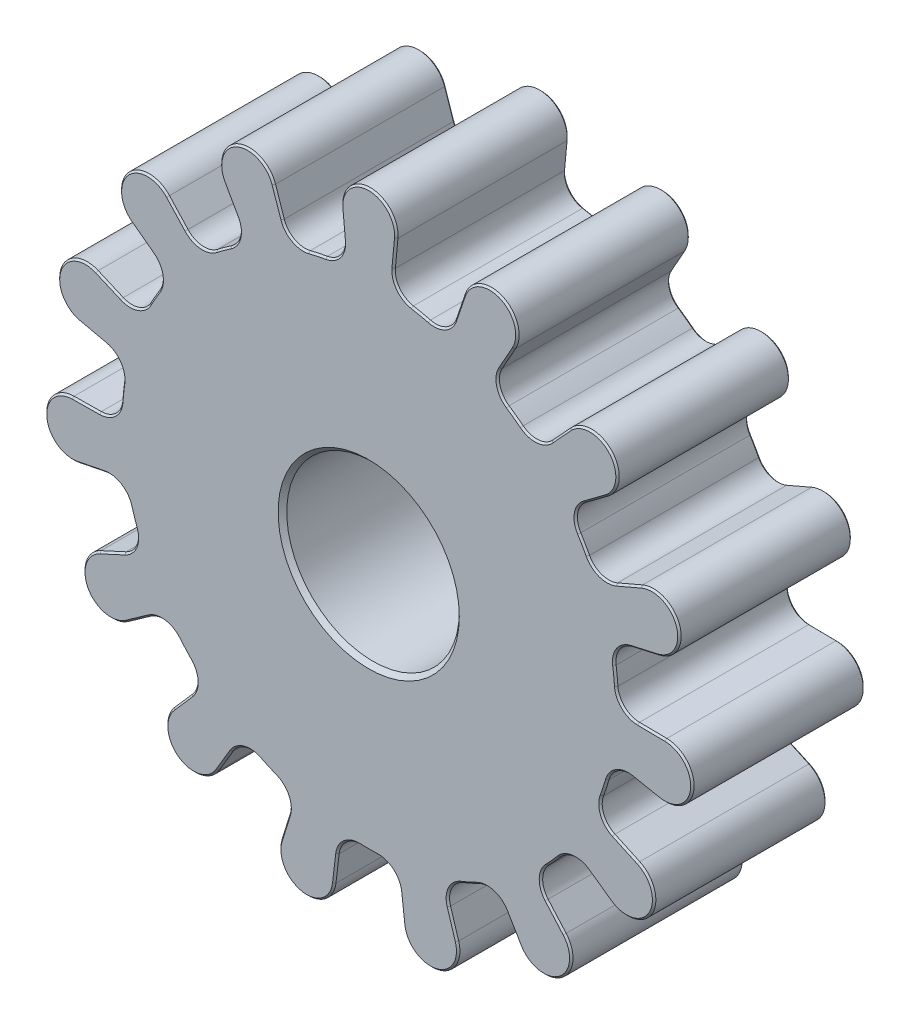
SolidWorks part; units mm, degrees
ref_plane "Спереди" through (0, 0, 0) normal (0, 0, 1) x (1, 0, 0)
ref_plane "Сверху" through (0, 0, 0) normal (0, 1, 0) x (1, 0, 0)
ref_plane "Справа" through (0, 0, 0) normal (1, 0, 0) x (0, 0, -1)
sketch "Эскиз1" plane through (0, 0, 0) normal (0, 0, 1) x (1, 0, 0)
  line L0 (-1.4463, 15.5261) -> (-1.5931, 17.1016)
  line L1 (1.4463, 15.5261) -> (1.5931, 17.1016)
  line L2 (4.9938, 14.7721) -> (5.5005, 16.2711)
  line L3 (7.6364, 13.5956) -> (8.4112, 14.9751)
  line L4 (10.5704, 11.4639) -> (11.643, 12.6271)
  line L5 (12.506, 9.3142) -> (13.775, 10.2593)
  line L6 (14.3193, 6.1734) -> (15.7723, 6.7998)
  line L7 (15.2132, 3.4223) -> (16.7569, 3.7696)
  line L8 (15.5923, -0.1845) -> (17.1744, -0.2032)
  line L9 (15.2899, -3.0613) -> (16.8414, -3.372)
  line L10 (14.1692, -6.5105) -> (15.607, -7.1711)
  line L11 (12.7229, -9.0156) -> (14.0139, -9.9305)
  line L12 (10.2962, -11.7108) -> (11.3409, -12.8991)
  line L13 (7.9559, -13.4111) -> (8.7632, -14.7719)
  line L14 (4.6428, -14.8862) -> (5.1139, -16.3967)
  line L15 (1.8133, -15.4876) -> (1.9973, -17.0591)
  line L16 (-1.8133, -15.4876) -> (-1.9973, -17.0591)
  line L17 (-4.6428, -14.8862) -> (-5.1139, -16.3967)
  line L18 (-7.9559, -13.4111) -> (-8.7632, -14.7719)
  line L19 (-10.2962, -11.7108) -> (-11.3409, -12.8991)
  line L20 (-12.7229, -9.0156) -> (-14.0139, -9.9305)
  line L21 (-14.1692, -6.5105) -> (-15.607, -7.1711)
  line L22 (-15.2899, -3.0613) -> (-16.8414, -3.372)
  line L23 (-15.5923, -0.1845) -> (-17.1744, -0.2032)
  line L24 (-15.2132, 3.4223) -> (-16.7569, 3.7696)
  line L25 (-14.3193, 6.1734) -> (-15.7723, 6.7998)
  line L26 (-12.506, 9.3142) -> (-13.775, 10.2593)
  line L27 (-10.5704, 11.4639) -> (-11.643, 12.6271)
  line L28 (-7.6364, 13.5956) -> (-8.4112, 14.9751)
  line L29 (-4.9938, 14.7721) -> (-5.5005, 16.2711)
  line L32 (-1.2117, 13.0078) -> (-1.2944, 13.8952)
  line L33 (1.1863, 12.7348) -> (1.3, 13.9549)
  line L34 (2.7413, 11.8981) -> (3.0267, 12.7424)
  line L35 (4.9134, 11.4047) -> (5.5135, 12.4731)
  line L36 (6.729, 11.0759) -> (7.3332, 11.7311)
  line L37 (9.1147, 10.0723) -> (10.0974, 10.8042)
  line L38 (11.5109, 9.1116) -> (12.3293, 9.4645)
  line L39 (13.7853, 6.9624) -> (14.9808, 7.2314)
  line L40 (16.0254, 4.5549) -> (16.9166, 4.5443)
  line L41 (17.2944, 1.1325) -> (18.4959, 0.8919)
  line L42 (18.1908, -2.6333) -> (19.0006, -3.0055)
  line L43 (17.6171, -6.697) -> (18.6169, -7.4054)
  line L44 (16.3227, -10.8344) -> (16.9112, -11.5038)
  line L45 (13.629, -14.3946) -> (14.2542, -15.4485)
  line L46 (10.138, -17.4971) -> (10.4034, -18.3479)
  line L47 (5.8262, -19.3836) -> (5.9687, -20.6007)
  line L48 (1.0523, -20.2836) -> (0.9487, -21.1688)
  line L49 (-3.7354, -19.8139) -> (-4.1002, -20.9837)
  line L50 (-8.3199, -18.1303) -> (-8.7746, -18.8968)
  line L51 (-12.2391, -15.4158) -> (-13.0482, -16.336)
  line L52 (-15.2314, -11.7338) -> (-15.9586, -12.2491)
  line L53 (-17.2688, -7.6338) -> (-18.3823, -8.1455)
  line L54 (-17.9257, -3.2337) -> (-18.7996, -3.4087)
  line L55 (-17.7746, 1.0201) -> (-18.9999, 1.0056)
  line L56 (-16.2777, 4.7483) -> (-17.1473, 4.9439)
  line L57 (-14.3793, 8.0703) -> (-15.5046, 8.5554)
  line L58 (-11.6519, 10.2296) -> (-12.3667, 10.762)
  line L59 (-8.8969, 12.0867) -> (-9.7275, 12.9875)
  line L60 (-6.0802, 12.6003) -> (-6.5167, 13.3774)
  line L61 (-3.3334, 13.1231) -> (-3.7259, 14.2839)
  circle A0 centre (0, 0) radius 17.25 construction
  arc A1 (1.5931, 17.1016) -> (-1.5931, 17.1016) centre (0, 17.25) ccw
  arc A2 (-2.4908, 14.1576) -> (-3.4829, 13.9467) centre (0, 0) ccw
  arc A3 (8.4112, 14.9751) -> (5.5005, 16.2711) centre (7.0162, 15.7587) ccw
  arc A4 (13.775, 10.2593) -> (11.643, 12.6271) centre (12.8192, 11.5425) ccw
  arc A5 (16.7569, 3.7696) -> (15.7723, 6.7998) centre (16.4057, 5.3305) ccw
  arc A6 (16.8414, -3.372) -> (17.1744, -0.2032) centre (17.1555, -1.8031) ccw
  arc A7 (14.0139, -9.9305) -> (15.607, -7.1711) centre (14.9389, -8.625) ccw
  arc A8 (8.7632, -14.7719) -> (11.3409, -12.8991) centre (10.1393, -13.9555) ccw
  arc A9 (1.9973, -17.0591) -> (5.1139, -16.3967) centre (3.5865, -16.873) ccw
  arc A10 (-5.1139, -16.3967) -> (-1.9973, -17.0591) centre (-3.5865, -16.873) ccw
  arc A11 (-11.3409, -12.8991) -> (-8.7632, -14.7719) centre (-10.1393, -13.9555) ccw
  arc A12 (-15.607, -7.1711) -> (-14.0139, -9.9305) centre (-14.9389, -8.625) ccw
  arc A13 (-17.1744, -0.2032) -> (-16.8414, -3.372) centre (-17.1555, -1.8031) ccw
  arc A14 (-15.7723, 6.7998) -> (-16.7569, 3.7696) centre (-16.4057, 5.3305) ccw
  arc A15 (-11.643, 12.6271) -> (-13.775, 10.2593) centre (-12.8192, 11.5425) ccw
  arc A16 (-5.5005, 16.2711) -> (-8.4112, 14.9751) centre (-7.0162, 15.7587) ccw
  arc A17 (3.4829, 13.9467) -> (2.4908, 14.1576) centre (0, 0) ccw
  arc A18 (8.8544, 11.3243) -> (8.0339, 11.9205) centre (0, 0) ccw
  arc A19 (12.6949, 6.7438) -> (12.1878, 7.6222) centre (0, 0) ccw
  arc A20 (14.3404, 0.9973) -> (14.2343, 2.006) centre (0, 0) ccw
  arc A21 (-8.0339, 11.9205) -> (-8.8544, 11.3243) centre (0, 0) ccw
  arc A22 (-12.1878, 7.6222) -> (-12.6949, 6.7438) centre (0, 0) ccw
  arc A23 (-14.2343, 2.006) -> (-14.3404, 0.9973) centre (0, 0) ccw
  arc A24 (-13.8196, -3.957) -> (-13.5062, -4.9217) centre (0, 0) ccw
  arc A25 (-11.0154, -9.2359) -> (-10.3367, -9.9896) centre (0, 0) ccw
  arc A26 (-6.3065, -12.9178) -> (-5.3799, -13.3303) centre (0, 0) ccw
  arc A27 (-0.5071, -14.3661) -> (0.5071, -14.3661) centre (0, 0) ccw
  arc A28 (5.3799, -13.3303) -> (6.3065, -12.9178) centre (0, 0) ccw
  arc A29 (10.3367, -9.9896) -> (11.0154, -9.2359) centre (0, 0) ccw
  arc A30 (13.5062, -4.9217) -> (13.8196, -3.957) centre (0, 0) ccw
  arc A31 (7.9559, -13.4111) -> (6.3065, -12.9178) centre (6.8637, -14.059) ccw
  arc A32 (4.6428, -14.8862) -> (5.3799, -13.3303) centre (5.8552, -14.508) cw
  circle A33 centre (0, 0) radius 5
  arc A34 (1.8133, -15.4876) -> (0.5071, -14.3661) centre (0.5519, -15.6353) ccw
  arc A35 (-1.8133, -15.4876) -> (-0.5071, -14.3661) centre (-0.5519, -15.6353) cw
  arc A36 (-4.6428, -14.8862) -> (-5.3799, -13.3303) centre (-5.8552, -14.508) ccw
  arc A37 (-7.9559, -13.4111) -> (-6.3065, -12.9178) centre (-6.8637, -14.059) cw
  arc A38 (-10.2962, -11.7108) -> (-10.3367, -9.9896) centre (-11.2499, -10.8722) ccw
  arc A39 (-12.7229, -9.0156) -> (-11.0154, -9.2359) centre (-11.9886, -10.0519) cw
  arc A40 (-14.1692, -6.5105) -> (-13.5062, -4.9217) centre (-14.6995, -5.3565) ccw
  arc A41 (-15.2899, -3.0613) -> (-13.8196, -3.957) centre (-15.0406, -4.3066) cw
  arc A42 (-15.5923, -0.1845) -> (-14.3404, 0.9973) centre (-15.6073, 1.0854) ccw
  arc A43 (-15.2132, 3.4223) -> (-14.2343, 2.006) centre (-15.4919, 2.1833) cw
  arc A44 (-14.3193, 6.1734) -> (-12.6949, 6.7438) centre (-13.8165, 7.3396) ccw
  arc A45 (-12.506, 9.3142) -> (-12.1878, 7.6222) centre (-13.2646, 8.2956) cw
  arc A46 (10.2962, -11.7108) -> (10.3367, -9.9896) centre (11.2499, -10.8722) cw
  arc A47 (12.7229, -9.0156) -> (11.0154, -9.2359) centre (11.9886, -10.0519) ccw
  arc A48 (14.1692, -6.5105) -> (13.5062, -4.9217) centre (14.6995, -5.3565) cw
  arc A49 (15.2899, -3.0613) -> (13.8196, -3.957) centre (15.0406, -4.3066) ccw
  arc A50 (15.2132, 3.4223) -> (14.2343, 2.006) centre (15.4919, 2.1833) ccw
  arc A51 (14.3193, 6.1734) -> (12.6949, 6.7438) centre (13.8165, 7.3396) cw
  arc A52 (12.506, 9.3142) -> (12.1878, 7.6222) centre (13.2646, 8.2956) ccw
  arc A53 (10.5704, 11.4639) -> (8.8544, 11.3243) centre (9.6367, 12.3248) cw
  arc A54 (7.6364, 13.5956) -> (8.0339, 11.9205) centre (8.7436, 12.9736) ccw
  arc A55 (-10.5704, 11.4639) -> (-8.8544, 11.3243) centre (-9.6367, 12.3248) ccw
  arc A56 (-7.6364, 13.5956) -> (-8.0339, 11.9205) centre (-8.7436, 12.9736) cw
  arc A57 (-4.9938, 14.7721) -> (-3.4829, 13.9467) centre (-3.7906, 15.1788) ccw
  arc A58 (-1.4463, 15.5261) -> (-2.4908, 14.1576) centre (-2.7109, 15.4083) cw
  arc A59 (4.9938, 14.7721) -> (3.4829, 13.9467) centre (3.7906, 15.1788) cw
  arc A60 (1.4463, 15.5261) -> (2.4908, 14.1576) centre (2.7109, 15.4083) ccw
  arc A61 (15.5923, -0.1845) -> (14.3404, 0.9973) centre (15.6073, 1.0854) cw
  arc A66 (1.5931, 17.1016) -> (-1.5931, 17.1016) centre (0, 17.25) ccw
  arc A67 (7.45, 15.9207) -> (4.5393, 17.2167) centre (6.055, 16.7043) ccw
  arc A68 (12.3203, 12.4598) -> (10.1883, 14.8276) centre (11.3646, 13.743) ccw
  arc A69 (15.3617, 7.3171) -> (14.3772, 10.3473) centre (15.0106, 8.8781) ccw
  arc A70 (16.0486, 1.3819) -> (16.3816, 4.5507) centre (16.3627, 2.9508) ccw
  arc A71 (14.262, -4.3195) -> (15.8551, -1.5601) centre (15.187, -3.014) ccw
  arc A72 (10.3109, -8.8013) -> (12.8886, -6.9285) centre (11.6869, -7.9849) ccw
  arc A73 (4.8784, -11.2885) -> (7.995, -10.6261) centre (6.4676, -11.1025) ccw
  arc A74 (-1.096, -11.3512) -> (2.0206, -12.0137) centre (0.4314, -11.8276) ccw
  arc A75 (-6.5794, -8.9784) -> (-4.0017, -10.8512) centre (-5.3778, -10.0349) ccw
  arc A76 (-10.6236, -4.5805) -> (-9.0305, -7.3398) centre (-9.9556, -6.0344) ccw
  arc A77 (-12.5294, 1.0822) -> (-12.1964, -2.0866) centre (-12.5105, -0.5177) ccw
  arc A78 (-11.9673, 7.0304) -> (-12.9519, 4.0002) centre (-12.6007, 5.5611) ccw
  arc A79 (-9.0343, 12.2358) -> (-11.1663, 9.8679) centre (-10.2106, 11.1512) ccw
  arc A80 (-4.2377, 15.7981) -> (-7.1485, 14.5022) centre (-5.7535, 15.2857) ccw
  point P81 (7.3343, -12.3632)
  point P84 (4.28, -13.723)
  point P87 (1.6716, -14.2775)
  point P90 (-1.6716, -14.2775)
  point P93 (-4.28, -13.723)
  point P96 (-7.3343, -12.3632)
  point P99 (-9.4917, -10.7958)
  point P102 (-11.7288, -8.3112)
  point P105 (-13.0621, -6.0018)
  point P108 (-14.0953, -2.8221)
  point P111 (-14.374, -0.1701)
  point P114 (-14.0245, 3.1549)
  point P117 (-13.2005, 5.691)
  point P120 (-11.5288, 8.5864)
  point P123 (9.4917, -10.7958)
  point P126 (11.7288, -8.3112)
  point P129 (13.0621, -6.0018)
  point P136 (13.2005, 5.691)
  point P141 (9.7445, 10.5681)
  point P146 (-9.7445, 10.5681)
  point P149 (-7.0397, 12.5333)
  point P156 (4.6036, 13.6179)
  point P161 (14.374, -0.1701)
  dimension "D1" = 34.5
  dimension "D2" = 3.2
  dimension "D3" = 14.375
  dimension "D5" = 10
  dimension "D6" = 15
  dimension "D7" = 1.27
  dimension "D8" = 1.27
  dimension "D4" = 15
extrude "Бобышка-Вытянуть1" add sketch "Эскиз1" along normal blind 10
chamfer "Фаска1" distance 0.25 angle 45 2 edges at (5, 0, 0) (5, 0, 10)
chamfer "Фаска2" distance 0.1 angle 45 180 edges at (0, -14.375, 0) (1.3793, -14.6717, 0) (-1.3793, -14.6717, 0) (1.9053, -16.2733, 0) (-1.9053, -16.2733, 0) (3.9191, -18.4381, 0) (-3.9191, -18.4381, 0) (4.8784, -15.6414, 0) (-4.8784, -15.6414, 0) (4.7075, -13.9643, 0) (-4.7075, -13.9643, 0) (5.8468, -13.1322, 0) (-5.8468, -13.1322, 0) (7.2276, -12.8423, 0) (-7.2276, -12.8423, 0) (8.3596, -14.0915, 0) (-8.3596, -14.0915, 0) (11.0798, -15.25, 0) (-11.0798, -15.25, 0) (10.8185, -12.3049, 0) (-10.8185, -12.3049, 0) (9.9803, -10.8423, 0) (-9.9803, -10.8423, 0) (10.6827, -9.6188, 0) (-10.6827, -9.6188, 0) (11.8261, -8.7923, 0) (-11.8261, -8.7923, 0) (13.3684, -9.4731, 0) (-13.3684, -9.4731, 0) (16.3246, -9.425, 0) (-16.3246, -9.425, 0) (14.8881, -6.8408, 0) (-14.8881, -6.8408, 0) (13.5274, -5.8456, 0) (-13.5274, -5.8456, 0) (13.6714, -4.4421, 0) (-13.6714, -4.4421, 0) (14.3798, -3.222, 0) (-14.3798, -3.222, 0) (16.0656, -3.2167, 0) (-16.0656, -3.2167, 0) (18.7467, -1.9704, 0) (-18.7467, -1.9704, 0) (16.3834, -0.1939, 0) (-16.3834, -0.1939, 0) (14.7355, 0.1619, 0) (-14.7355, 0.1619, 0) (14.2963, 1.5026, 0) (-14.2963, 1.5026, 0) (14.4472, 2.9053, 0) (-14.4472, 2.9053, 0) (15.985, 3.5959, 0) (-15.985, 3.5959, 0) (17.9274, 5.825, 0) (-17.9274, 5.825, 0) (15.0458, 6.4866, 0) (-15.0458, 6.4866, 0) (13.3957, 6.1414, 0) (-13.3957, 6.1414, 0) (12.4491, 7.1875, 0) (-12.4491, 7.1875, 0) (12.0164, 8.5303, 0) (-12.0164, 8.5303, 0) (13.1405, 9.7867, 0) (-13.1405, 9.7867, 0) (14.0083, 12.6131, 0) (-14.0083, 12.6131, 0) (11.1067, 12.0455, 0) (-11.1067, 12.0455, 0) (9.7397, 11.0589, 0) (-9.7397, 11.0589, 0) (8.4494, 11.6296, 0) (-8.4494, 11.6296, 0) (7.508, 12.6804, 0) (-7.508, 12.6804, 0) (8.0238, 14.2853, 0) (-8.0238, 14.2853, 0) (7.667, 17.2203, 0) (-7.667, 17.2203, 0) (5.2471, 15.5216, 0) (-5.2471, 15.5216, 0) (4.3996, 14.0643, 0) (-4.3996, 14.0643, 0) (2.9887, 14.0609, 0) (-2.9887, 14.0609, 0) (1.7013, 14.6379, 0) (-1.7013, 14.6379, 0) (1.5197, 16.3139, 0) (-1.5197, 16.3139, 0) (0, 18.85, 0) (-5.8468, -13.1322, 10) (-4.7075, -13.9643, 10) (-7.2276, -12.8423, 10) (-4.8784, -15.6414, 10) (-8.3596, -14.0915, 10) (-3.9191, -18.4381, 10) (-11.0798, -15.25, 10) (-1.9053, -16.2733, 10) (-10.8185, -12.3049, 10) (-1.3793, -14.6717, 10) (-9.9803, -10.8423, 10) (0, -14.375, 10) (-10.6827, -9.6188, 10) (1.3793, -14.6717, 10) (-11.8261, -8.7923, 10) (1.9053, -16.2733, 10) (-13.3684, -9.4731, 10) (3.9191, -18.4381, 10) (-16.3246, -9.425, 10) (4.8784, -15.6414, 10) (-14.8881, -6.8408, 10) (4.7075, -13.9643, 10) (-13.5274, -5.8456, 10) (5.8468, -13.1322, 10) (-13.6714, -4.4421, 10) (7.2276, -12.8423, 10) (-14.3798, -3.222, 10) (8.3596, -14.0915, 10) (-16.0656, -3.2167, 10) (11.0798, -15.25, 10) (-18.7467, -1.9704, 10) (10.8185, -12.3049, 10) (-16.3834, -0.1939, 10) (9.9803, -10.8423, 10) (-14.7355, 0.1619, 10) (10.6827, -9.6188, 10) (-14.2963, 1.5026, 10) (11.8261, -8.7923, 10) (-14.4472, 2.9053, 10) (13.3684, -9.4731, 10) (-15.985, 3.5959, 10) (16.3246, -9.425, 10) (-17.9274, 5.825, 10) (14.8881, -6.8408, 10) (-15.0458, 6.4866, 10) (13.5274, -5.8456, 10) (-13.3957, 6.1414, 10) (13.6714, -4.4421, 10) (-12.4491, 7.1875, 10) (14.3798, -3.222, 10) (-12.0164, 8.5303, 10) (16.0656, -3.2167, 10) (-13.1405, 9.7867, 10) (18.7467, -1.9704, 10) (-14.0083, 12.6131, 10) (16.3834, -0.1939, 10) (-11.1067, 12.0455, 10) (14.7355, 0.1619, 10) (-9.7397, 11.0589, 10) (14.2963, 1.5026, 10) (-8.4494, 11.6296, 10) (14.4472, 2.9053, 10) (-7.508, 12.6804, 10) (15.985, 3.5959, 10) (-8.0238, 14.2853, 10) (17.9274, 5.825, 10) (-7.667, 17.2203, 10) (15.0458, 6.4866, 10) (-5.2471, 15.5216, 10) (13.3957, 6.1414, 10) (-4.3996, 14.0643, 10) (12.4491, 7.1875, 10) (-2.9887, 14.0609, 10) (12.0164, 8.5303, 10) (-1.7013, 14.6379, 10) (13.1405, 9.7867, 10) (-1.5197, 16.3139, 10) (14.0083, 12.6131, 10) (0, 18.85, 10) (11.1067, 12.0455, 10) (1.5197, 16.3139, 10) (9.7397, 11.0589, 10) (1.7013, 14.6379, 10) (8.4494, 11.6296, 10) (2.9887, 14.0609, 10) (7.508, 12.6804, 10) (4.3996, 14.0643, 10) (8.0238, 14.2853, 10) (5.2471, 15.5216, 10) (7.667, 17.2203, 10)
